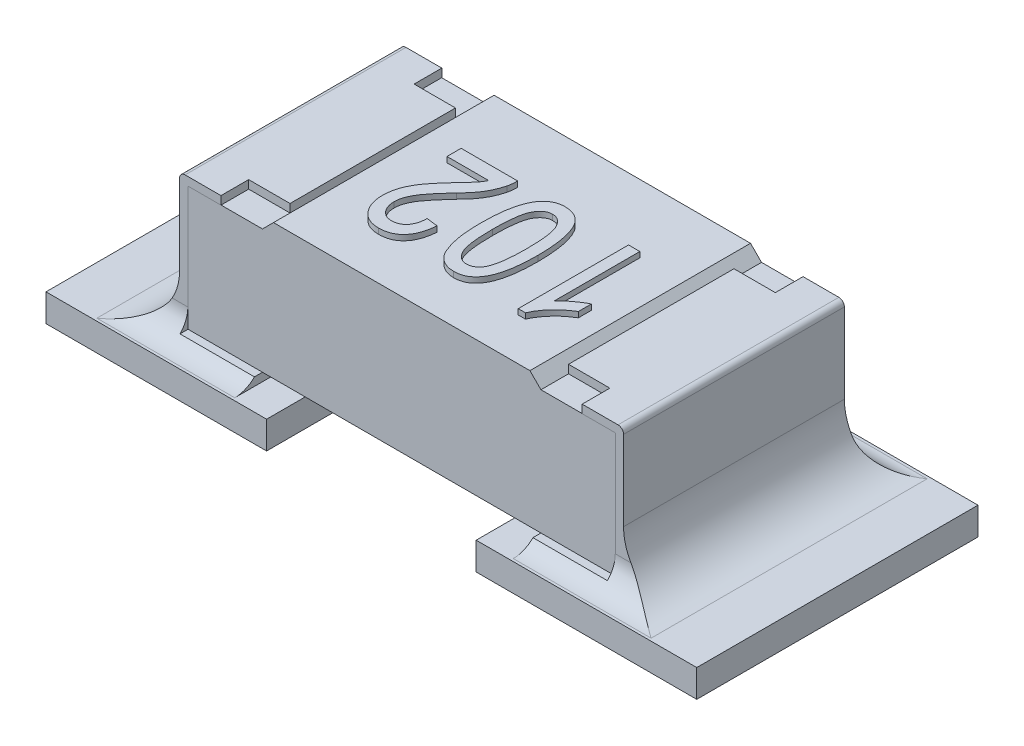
SolidWorks part; units mm, degrees
ref_plane "Plan de face" through (0, 0, 0) normal (0, 0, 1) x (1, 0, 0)
ref_plane "Plan de dessus" through (0, 0, 0) normal (0, 1, 0) x (1, 0, 0)
ref_plane "Plan de droite" through (0, 0, 0) normal (1, 0, 0) x (0, 0, -1)
sketch "Esquisse1" plane through (0, 0, 0) normal (1, 0, 0) x (0, 0, -1)
  line L1 (-0.4, 0.58) -> (0.4, 0.58)
  line L2 (-0.4, 0.58) -> (-0.4, 0.13)
  line L3 (-0.4, 0.13) -> (0.4, 0.13)
  line L4 (0.4, 0.58) -> (0.4, 0.13)
  dimension "D1" = 0.13
  dimension "D2" = 0.4
  dimension "D3" = 0.8
  dimension "D4" = 0.45
extrude "Extrusion1" add sketch "Esquisse1" along normal mid plane 1.55
sketch "Esquisse2" plane through (0, 0, 0) normal (0, 0, 1) x (1, 0, 0)
  line L4 (-0.505, 0.61) -> (-0.505, 0.58)
  line L5 (0.775, 0.58) -> (-0.775, 0.58) construction
  line L6 (-0.505, 0.13) -> (-0.505, 0.1)
  line L7 (0.775, 0.13) -> (-0.775, 0.13) construction
  line L8 (-0.805, 0.61) -> (-0.805, 0.1)
  line L9 (-0.805, 0.1) -> (0.805, 0.1)
  line L10 (0.805, 0.1) -> (0.805, 0.61)
  line L11 (0.805, 0.61) -> (-0.805, 0.61)
  line L12 (-0.805, 0.59) -> (-0.805, 0.1)
  line L13 (0.505, 0.61) -> (0.785, 0.61)
  line L14 (0.805, 0.1) -> (0.805, 0.59)
  line L15 (0.505, 0.1) -> (0.805, 0.1)
  line L16 (0.505, 0.61) -> (0.505, 0.58)
  line L17 (0.505, 0.13) -> (0.505, 0.1)
  line L18 (0.505, 0.13) -> (0.775, 0.13)
  line L19 (0.775, 0.13) -> (0.775, 0.58)
  line L20 (0.775, 0.58) -> (0.505, 0.58)
  line L21 (-0.505, 0.1) -> (-0.805, 0.1)
  line L22 (-0.505, 0.13) -> (-0.775, 0.13)
  line L23 (-0.775, 0.13) -> (-0.775, 0.58)
  line L24 (-0.775, 0.58) -> (-0.505, 0.58)
  line L26 (-0.785, 0.61) -> (-0.505, 0.61)
  arc A0 (0.805, 0.59) -> (0.785, 0.61) centre (0.785, 0.59) ccw
  arc A1 (-0.785, 0.61) -> (-0.805, 0.59) centre (-0.785, 0.59) ccw
  dimension "D4" = 0.02
  dimension "D2" = 0.3
  dimension "D3" = 0.3
  dimension "D1" = 0.03
extrude "Extrusion2" add sketch "Esquisse2" along normal mid plane 0.801
sketch "Esquisse3" plane through (0, 0.61, 0) normal (0, 1, 0) x (-1, 0, 0)
  line L0 (0.505, 0.4005) -> (0.505, -0.4005) construction
  line L1 (0.505, -0.5) -> (0.655, -0.5)
  line L2 (0.505, -0.5) -> (0.505, -0.3)
  line L3 (0.505, -0.3) -> (0.655, -0.3)
  line L4 (0.655, -0.5) -> (0.655, -0.3)
  line L5 (0, 0) -> (0, 0.6053) construction
  line L6 (-0.655, -0.5) -> (-0.655, -0.3)
  line L7 (-0.505, -0.3) -> (-0.655, -0.3)
  line L8 (-0.505, -0.5) -> (-0.505, -0.3)
  line L9 (-0.505, -0.5) -> (-0.655, -0.5)
  line L10 (0, 0) -> (0.2891, 0) construction
  line L11 (-0.505, 0.5) -> (-0.655, 0.5)
  line L12 (-0.505, 0.5) -> (-0.505, 0.3)
  line L13 (-0.505, 0.3) -> (-0.655, 0.3)
  line L14 (-0.655, 0.5) -> (-0.655, 0.3)
  line L15 (0.655, 0.5) -> (0.655, 0.3)
  line L16 (0.505, 0.3) -> (0.655, 0.3)
  line L17 (0.505, 0.5) -> (0.505, 0.3)
  line L18 (0.505, 0.5) -> (0.655, 0.5)
  dimension "D1" = 0.15
  dimension "D2" = 0.2
  dimension "D3" = 0.3
extrude "Enlèv. mat.-Extru.4" cut sketch "Esquisse3" against normal blind 0.03
sketch "Esquisse4" plane through (0, 0, 0) normal (0, 0, 1) x (1, 0, 0)
  line L0 (-0.505, 0.58) -> (-0.465, 0.62)
  line L1 (-0.465, 0.62) -> (0.465, 0.62)
  line L2 (0.465, 0.62) -> (0.505, 0.58)
  line L4 (0.505, 0.58) -> (-0.505, 0.58)
  line L8 (0.505, 0.61) -> (0.655, 0.61) construction
  point P3 (0.58, 0.61)
  dimension "D1" = 45
  dimension "D2" = 45
  dimension "D3" = 0.01
extrude "Extrusion5" add sketch "Esquisse4" along normal mid plane 0.8
sketch "Esquisse5" plane through (0, 0, 0) normal (0, 1, 0) x (1, 0, 0)
  line L0 (0, 0) -> (0, -0.6254) construction
  line L1 (-1.18, 0.51) -> (-0.38, 0.51)
  line L2 (-1.18, 0.51) -> (-1.18, -0.51)
  line L3 (-1.18, -0.51) -> (-0.38, -0.51)
  line L4 (-0.38, 0.51) -> (-0.38, -0.51)
  line L5 (0.38, 0.51) -> (0.38, -0.51)
  line L6 (1.18, -0.51) -> (0.38, -0.51)
  line L7 (1.18, 0.51) -> (1.18, -0.51)
  line L8 (1.18, 0.51) -> (0.38, 0.51)
  dimension "D1" = 0.38
  dimension "D2" = 1.02
  dimension "D3" = 0.51
  dimension "D4" = 0.8
extrude "Extrusion4" add sketch "Esquisse5" along normal blind 0.1
fillet "Congé1" radius 0.2 2 edges at (-0.805, 0.1, 0) (0.805, 0.1, 0)
fillet "Congé2" radius 0.1 12 edges at (-0.64, 0.13, -0.4005) (-0.755, 0.1, -0.4005) (-0.505, 0.115, -0.4005) (-0.755, 0.1, 0.4005) (-0.505, 0.115, 0.4005) (-0.64, 0.13, 0.4005) (0.64, 0.13, -0.4005) (0.755, 0.1, -0.4005) (0.505, 0.115, -0.4005) (0.755, 0.1, 0.4005) (0.64, 0.13, 0.4005) (0.505, 0.115, 0.4005)
sketch "Esquisse6" plane through (0, 0.62, 0) normal (0, 1, 0) x (-1, 0, 0)
  line L1 (-0.4332, -0.1535) -> (0.3855, -0.1535) construction
  text T0 "102" font "Arial" height 0.4
extrude "Extrusion6" add sketch "Esquisse6" along normal blind 0.02
